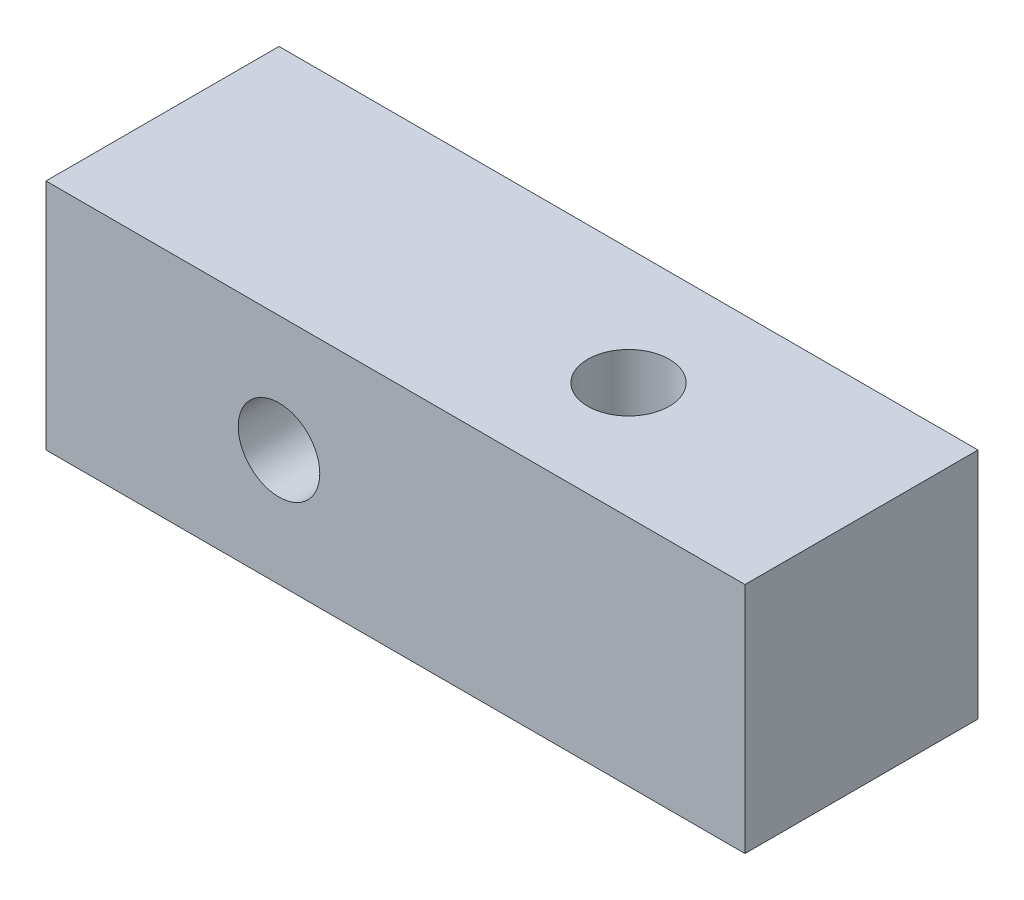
SolidWorks part; units mm, degrees
ref_plane "Přední rovina" through (0, 0, 0) normal (0, 0, 1) x (1, 0, 0)
ref_plane "Horní rovina" through (0, 0, 0) normal (0, 1, 0) x (1, 0, 0)
ref_plane "Pravá rovina" through (0, 0, 0) normal (1, 0, 0) x (0, 0, -1)
sketch "Skica1" plane through (0, 0, 0) normal (0, 0, 1) x (1, 0, 0)
  line L0 (-43.5113, -4.8889) -> (-13.5113, -4.8889) construction
  line L1 (-43.5113, 0.1111) -> (-13.5113, 0.1111)
  line L2 (-43.5113, 0.1111) -> (-43.5113, -9.8889)
  line L3 (-43.5113, -9.8889) -> (-13.5113, -9.8889)
  line L4 (-13.5113, 0.1111) -> (-13.5113, -9.8889)
  circle A0 centre (-33.5113, -4.8889) radius 1.75
  dimension "D3" = 10
  dimension "D1" = 10
  dimension "D2" = 30
extrude "Přidat vysunutím1" add sketch "Skica1" along normal blind 10
sketch "Skica2" plane through (0, 0.1111, 0) normal (0, 1, 0) x (1, 0, 0)
  line L0 (-43.5113, -5) -> (-13.5113, -5) construction
  line L1 (-43.5113, -10) -> (-43.5113, 0) construction
  line L2 (-13.5113, -10) -> (-13.5113, 0) construction
  circle A0 centre (-23.5113, -5) radius 1.75
  dimension "D1" = 10
extrude "Odebrat vysunutím1" cut sketch "Skica2" against normal through all
